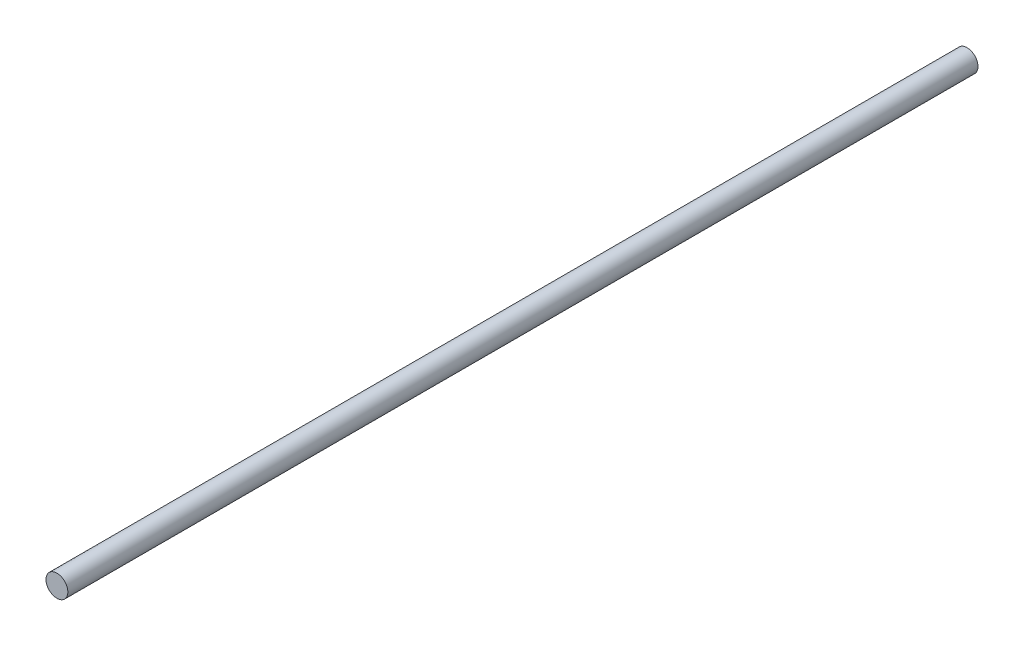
SolidWorks part; units mm, degrees
ref_plane "Front Plane" through (0, 0, 0) normal (0, 0, 1) x (1, 0, 0)
ref_plane "Top Plane" through (0, 0, 0) normal (0, 1, 0) x (1, 0, 0)
ref_plane "Right Plane" through (0, 0, 0) normal (1, 0, 0) x (0, 0, -1)
sketch "Sketch1" plane through (0, 0, 0) normal (0, 0, 1) x (1, 0, 0)
  circle A0 centre (0, 0) radius 30
  dimension "D1" = 60
extrude "Boss-Extrude1" add sketch "Sketch1" against normal blind 2500
